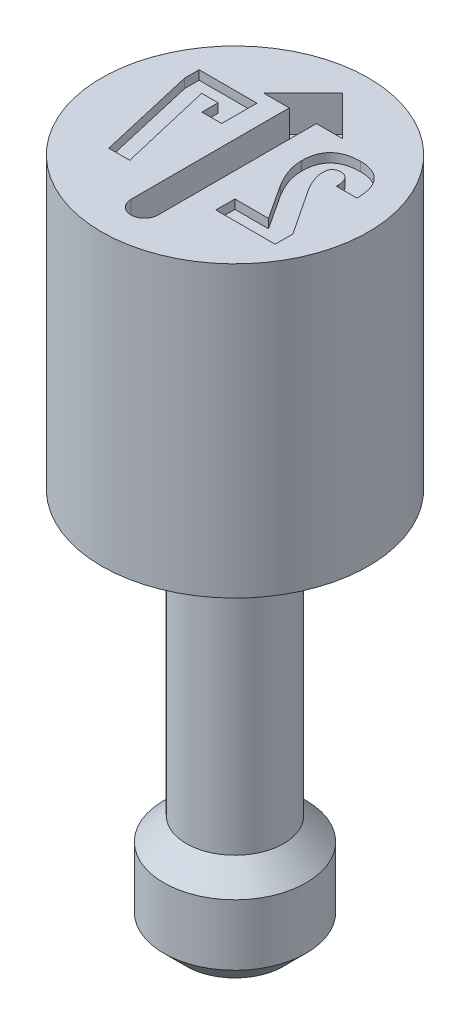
SolidWorks part; units mm, degrees
ref_plane "Front Plane" through (0, 0, 0) normal (0, 0, 1) x (1, 0, 0)
ref_plane "Top Plane" through (0, 0, 0) normal (0, 1, 0) x (1, 0, 0)
ref_plane "Right Plane" through (0, 0, 0) normal (1, 0, 0) x (0, 0, -1)
sketch "Sketch1" plane through (0, 0, 0) normal (0, 0, 1) x (1, 0, 0)
  line L0 (0, 7.62) -> (1.4986, 7.62)
  line L1 (0, -1.6485) -> (0, 1.6485) construction
  line L2 (1.4986, 7.62) -> (1.4986, 4.3688)
  line L3 (1.4986, 4.3688) -> (0.5461, 4.3688)
  line L4 (0.5461, 4.3688) -> (0.5461, 1.1938)
  line L5 (0.5461, 1.1938) -> (0.8, 0.9399)
  line L6 (0.8, 0.9399) -> (0.8, 0.254)
  line L7 (0.8, 0.254) -> (0.546, 0)
  line L8 (1.6485, 0) -> (-1.6485, 0) construction
  line L9 (0.546, 0) -> (0, 0)
  line L10 (0, 0) -> (0, 7.62)
  line L11 (0, 0) -> (0, 64.9194) construction
  dimension "D1" = 7.62
  dimension "D2" = 1.1938
  dimension "D3" = 0.254
  dimension "D4" = 45
  dimension "D5" = 1.6
  dimension "D6" = 2.9972
  dimension "D7" = 1.0922
  dimension "D8" = 3.2512
revolve "Revolve1" add sketch "Sketch1" angle 360 about L11
sketch "Sketch2" plane through (0, 7.62, 0) normal (0, 1, 0) x (1, 0, 0)
  line L1 (0.1524, -1.016) -> (0.1524, 0.762)
  line L2 (-0.1524, -1.016) -> (-0.1524, 0.762)
  line L3 (0, -1.6485) -> (0, 1.6485) construction
  line L4 (-0.1524, 0.762) -> (-0.4445, 0.762)
  line L5 (0.1524, 0.762) -> (0.4445, 0.762)
  line L6 (0.4445, 0.762) -> (0, 1.2065)
  line L7 (0, 1.2065) -> (-0.4445, 0.762)
  line L8 (-1.6485, 0) -> (1.6485, 0) construction
  arc A0 (-0.1524, -1.016) -> (0.1524, -1.016) centre (0, -1.016) ccw
  dimension "D6" = 1.016
  dimension "D1" = 0.3048
  dimension "D3" = 0.889
  dimension "D4" = 0.4445
  dimension "D5" = 45
  dimension "D7" = 0.762
extrude "Cut-Extrude1" cut sketch "Sketch2" against normal blind 0.4064
sketch "Sketch3" plane through (0, 7.62, 0) normal (0, 1, 0) x (1, 0, 0)
  text T0 "2 7" font "Bahnschrift SemiCondensed" height 1.27
extrude "Cut-Extrude2" cut sketch "Sketch3" against normal blind 0.1016
